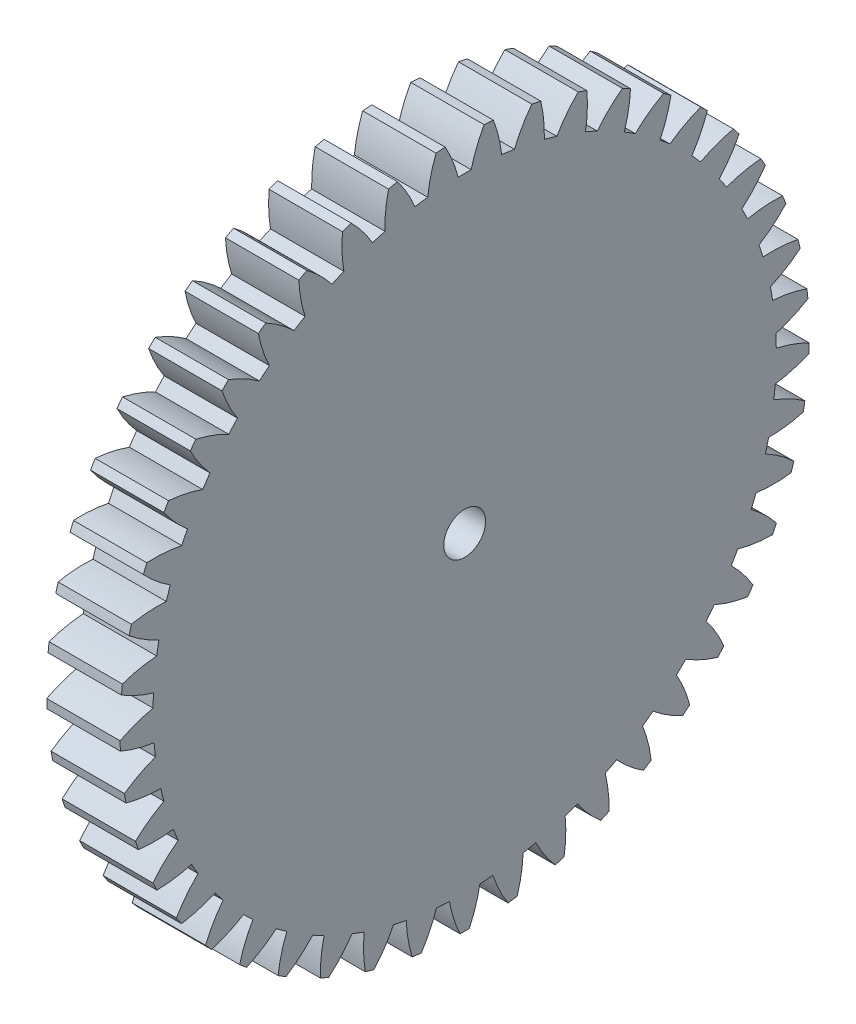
SolidWorks part; units mm, degrees
ref_plane "Plane1" through (0, 0, 0) normal (0, 0, 1) x (1, 0, 0)
ref_plane "Plane2" through (0, 0, 0) normal (0, 1, 0) x (1, 0, 0)
ref_plane "Plane3" through (0, 0, 0) normal (1, 0, 0) x (0, 0, -1)
other "Configuration Table"
sketch "HoldingSke" plane through (0, 0, 0) normal (0, 1, 0) x (1, 0, 0)
  line L0 (0, 0) -> (0.7071, -0.7071)
  line L1 (-15, 0) -> (100, 0) construction
  line L2 (0, 0) -> (-2.1039, 2.3779)
  line L3 (0, 0) -> (-11.863, 4.5341)
  line L4 (0, 0) -> (6.1066, 6.1066)
  line L5 (0, 0) -> (-46.8476, -17.4728)
  line L6 (0, 0) -> (-4.1448, -2.7965)
  line L7 (-2.1039, 2.3779) -> (8.6586, 51.2059)
  line L8 (-76.2, 54.61) -> (-75.9, 54.61)
  line L9 (-71.009, 38.7566) -> (-53.1078, 45.2721)
  line L10 (-76.2, 71.12) -> (104.1128, 71.12)
  line L11 (0, 0) -> (-5, 0)
  line L12 (-76.2, 101.6) -> (-76.162, 101.6)
  line L13 (24.9733, 27.94) -> (52.9518, 28.4284)
  line L14 (24.9733, 27.94) -> (24.9743, 27.94)
  line L15 (24.9733, 27.94) -> (100.4006, 29.5858)
  line L16 (-63.627, -1) -> (-12.827, -1)
  circle A0 centre (0, 0) radius 1
  circle A1 centre (0, 0) radius 21.249
  circle A2 centre (0, 0) radius 37.5
  circle A3 centre (0, 0) radius 1
sketch "BasProSke" plane through (0, 0, 0) normal (0, 1, 0) x (1, 0, 0)
  line L0 (-10, 0) -> (60, 0) construction
  line L1 (0, 0) -> (0, 23.5)
  line L2 (0, 0) -> (5, 0)
  line L3 (5, 0) -> (5, 23.5)
  line L4 (5, 23.5) -> (0, 23.5)
revolve "Base-Revolve" add sketch "BasProSke" angle 360 about L0
sketch "TooCutSke" plane through (0, 0, 0) normal (1, 0, 0) x (0, 0, -1)
  line L1 (0, 0) -> (0, 107) construction
  line L2 (0, 0) -> (-0.8517, 22.4839) construction
  line L3 (0, 0) -> (-3.1374, 44.8675) construction
  line L4 (-0.8517, 22.4839) -> (-1.5687, 22.4337) construction
  arc A0 (0.4426, 21.2444) -> (-0.4426, 21.2444) centre (0, 0) ccw
  arc A1 (1.3407, 23.4872) -> (-1.3407, 23.4872) centre (0, 0) ccw
  circle A2 centre (0, 0) radius 22.5 construction
  circle A3 centre (0, 0) radius 21.1431 construction
  arc A4 (-0.4426, 21.2444) -> (-1.3407, 23.4872) centre (-9.1711, 19.0505) ccw
  arc A5 (1.3407, 23.4872) -> (0.4426, 21.2444) centre (9.1711, 19.0505) ccw
extrude "ToothCut" cut sketch "TooCutSke" along normal through all
fillet "Breaks" [suppressed] radius 0.02
fillet "RootFillets" [suppressed] radius 0.251
pattern_circular "TeethCuts" count 45 every 8 about axis through (-10, 0, 0) along (1, 0, 0) of "ToothCut", "RootFillets", "Breaks"
sketch "HubNeaOneSke" plane through (0, 0, 0) normal (-1, 0, 0) x (0, 0, 1)
  circle A0 centre (0, 0) radius 21.249
extrude "HubNearOne" [suppressed] add sketch "HubNeaOneSke" along normal blind 45.0001
sketch "HubNeaBotSke" plane through (0, 0, 0) normal (-1, 0, 0) x (0, 0, 1)
  circle A0 centre (0, 0) radius 21.249
extrude "HubNearBoth" [suppressed] add sketch "HubNeaBotSke" along normal blind 22.5
ref_plane "FarPln" through (5, 0, 0) normal (1, 0, 0) x (0, 0, -1)
sketch "HubFarSke" plane through (5, 0, 0) normal (1, 0, 0) x (0, 0, -1)
  circle A0 centre (0, 0) radius 21.249
extrude "HubFar" [suppressed] add sketch "HubFarSke" along normal blind 22.5
sketch "BorSke" plane through (0, 0, 0) normal (1, 0, 0) x (0, 0, -1)
  circle A0 centre (0, 0) radius 1
extrude "Bore" cut sketch "BorSke" along normal mid plane 100.0001
sketch "KeySke" plane through (0, 0, 0) normal (1, 0, 0) x (0, 0, -1)
  line L0 (-0.4, 0) -> (-0.4, 1.3)
  line L1 (-0.4, 1.3) -> (0.4, 1.3)
  line L2 (0.4, 1.3) -> (0.4, 0)
  line L3 (0, 0) -> (0, 34) construction
  line L4 (-0.4, 0) -> (0.4, 0)
extrude "Keyway" [suppressed] cut sketch "KeySke" along normal mid plane 100.0001
pattern_circular "Keyway2" [suppressed] count 2 every 90 about axis through (-10, 0, 0) along (1, 0, 0)
sketch "Sketch1" plane through (5, 0, 0) normal (1, 0, 0) x (0, 0, -1)
  circle A0 centre (0, 0) radius 1.425
  dimension "D1" = 2.85
extrude "Cut-Extrude1" cut sketch "Sketch1" against normal blind 10
equation "' \"Module@HoldingSke\" = 6.35"
equation "' \"Num_teeth@HoldingSke\" = 12"
equation "' \"Ap@HoldingSke\" =  20"
equation "' \"Ap@HoldingSke\" = 20"
equation "' \"Width@HoldingSke\" = 0.5 * 25.4"
equation "' \"Hub_dia@HoldingSke\"= 1 * 25.4"
equation "' \"Hub_dia@HoldingSke\" = 1 * 25.4"
equation "' \"Overall_len@HoldingSke\" = 1.0 * 25.4"
equation "' \"Bore@HoldingSke\" = 0.75 * 25.4"
equation "' \"T_dim@HoldingSke\" = 0.1 * 25.4"
equation "' \"Width@KeySke\" = 0.25 * 25.4"
equation "' \"Show_teeth@HoldingSke\" = 13"
equation "' \"Backlash@HoldingSke\" = 0.009 * 25.4"
equation "' \"Addendum_fac@HoldingSke\" = 1.0"
equation "' \"Dedendum_fac@HoldingSke\" = 1.25"
equation "' \"Dedendum_add@HoldingSke\" = 0.00005 * 25.4"
equation "' \"Clearance_fac@HoldingSke\" = 0.25"
equation "\"Pitch@HoldingSke\" = 1 / \"Module@HoldingSke\""
equation "\"Overcut_dia@TooCutSke\" = (\"Num_teeth@HoldingSke\" + 2 * \"Addendum_fac@HoldingSke\") / \"Pitch@HoldingSke\" + 0.002 * 25.4"
equation "\"Pitch_dia@TooCutSke\" = \"Num_teeth@HoldingSke\" / \"Pitch@HoldingSke\""
equation "\"Base_dia@TooCutSke\" = \"Num_teeth@HoldingSke\" / \"Pitch@HoldingSke\" * cos((\"Ap@HoldingSke\"  * 3.14159265 / 180))"
equation "\"Root_dia@TooCutSke\" = (\"Num_teeth@HoldingSke\" + 2) / \"Pitch@HoldingSke\" - 2 * (\"Addendum_fac@HoldingSke\" + \"Dedendum_fac@HoldingSke\") / \"Pitch@HoldingSke\" - \"Dedendum_add@HoldingSke\" * 2"
equation "\"Half_ang@TooCutSke\" = 180 / \"Num_teeth@HoldingSke\""
equation "\"Half_CT@TooCutSke\" = \"Num_teeth@HoldingSke\" / \"Pitch@HoldingSke\" * sin((3.14159265 / 2 / \"Num_teeth@HoldingSke\")) / 2 - 7 * \"Backlash@HoldingSke\" / 4"
equation "\"Flank_rad@TooCutSke\" = \"Num_teeth@HoldingSke\" / \"Pitch@HoldingSke\" / 5"
equation "\"Radius@RootFillets\" = \"Clearance_fac@HoldingSke\" / \"Pitch@HoldingSke\" + \"Dedendum_add@HoldingSke\""
equation "\"Break_rad@Breaks\" = 0.02 / \"Pitch@HoldingSke\""
equation "\"Thickness@HoldingSke\" = \"Width@HoldingSke\""
equation "\"OAL@HoldingSke\" = \"Thickness@HoldingSke\""
equation "\"MHD@HoldingSke\" = (\"Num_teeth@HoldingSke\" + 2) / \"Pitch@HoldingSke\" - 2 * (\"Addendum_fac@HoldingSke\" + \"Dedendum_fac@HoldingSke\")  / \"Pitch@HoldingSke\" - \"Dedendum_add@HoldingSke\" * 2"
equation "\"MBD@HoldingSke\" = (\"Num_teeth@HoldingSke\" + 2) / \"Pitch@HoldingSke\" - 2 * (\"Addendum_fac@HoldingSke\" + \"Dedendum_fac@HoldingSke\")  / \"Pitch@HoldingSke\" - \"Dedendum_add@HoldingSke\" * 2 - 0.002 * 25.4"
equation "\"MHD@HoldingSke\" = ((sgn( \"MHD@HoldingSke\" - \"Hub_dia@HoldingSke\" )-1)*( \"MHD@HoldingSke\" - \"Hub_dia@HoldingSke\" ))/-2+ \"Hub_dia@HoldingSke\""
equation "\"MBD@HoldingSke\" = ((sgn( \"MBD@HoldingSke\" - \"Bore@HoldingSke\" )-1)*( \"MBD@HoldingSke\" - \"Bore@HoldingSke\" ))/-2+ \"Bore@HoldingSke\""
equation "\"OAL@HoldingSke\" = ((sgn( \"OAL@HoldingSke\" - \"Overall_len@HoldingSke\" )+1)*( \"OAL@HoldingSke\" - \"Overall_len@HoldingSke\" ))/2 + \"Overall_len@HoldingSke\" + 0.000002 * 25.4"
equation "\"Num_teeth@TeethCuts\" = int( \"Show_teeth@HoldingSke\" ) + 1"
equation "\"Num_teeth@TeethCuts\" = ((sgn( \"Num_teeth@TeethCuts\" - \"Num_teeth@HoldingSke\" )-1)*( \"Num_teeth@TeethCuts\" - \"Num_teeth@HoldingSke\" ))/-2+ \"Num_teeth@HoldingSke\""
equation "\"Num_teeth@TeethCuts\" = ((sgn( \"Num_teeth@TeethCuts\" - 2.0)+1)*( \"Num_teeth@TeethCuts\" - 2.0))/2 +2.0"
equation "\"Angle@TeethCuts\" = 360.0 / \"Num_teeth@HoldingSke\""
equation "\"Diameter@BasProSke\" = (\"Num_teeth@HoldingSke\" + 2 * \"Addendum_fac@HoldingSke\") / \"Pitch@HoldingSke\""
equation "\"Thickness@BasProSke\"  = \"Thickness@HoldingSke\""
equation "' \"Fillet_rad@BasProSke\" =  \"Thickness@HoldingSke\" * 0.05"
equation "' \"Fillet_rad@BasProSke\" = \"Thickness@HoldingSke\" * 0.05"
equation "\"MHD@HoldingSke\" = ((sgn( \"MHD@HoldingSke\" - \"Root_dia@TooCutSke\" )-1)*( \"MHD@HoldingSke\" - \"Root_dia@TooCutSke\" ))/-2+ \"Root_dia@TooCutSke\""
equation "\"Diameter@HubNeaOneSke\" = \"MHD@HoldingSke\""
equation "\"Length@HubNearOne\" = \"OAL@HoldingSke\" - \"Thickness@BasProSke\""
equation "\"Diameter@HubNeaBotSke\" = \"MHD@HoldingSke\""
equation "\"Length@HubNearBoth\" = ( \"OAL@HoldingSke\" - \"Thickness@BasProSke\" ) / 2.0"
equation "\"Thickness@FarPln\" = \"Thickness@BasProSke\""
equation "\"Diameter@HubFarSke\" = \"MHD@HoldingSke\""
equation "\"Length@HubFar\" = ( \"OAL@HoldingSke\" - \"Thickness@BasProSke\" ) / 2.0"
equation "\"Diameter@BorSke\" = \"MBD@HoldingSke\""
equation "\"D1@Bore\" = \"OAL@HoldingSke\" * 2.0"
equation "\"D1@Keyway\" = \"OAL@HoldingSke\" * 2.0"
equation "\"Offset@KeySke\" = \"T_dim@HoldingSke\" + \"MBD@HoldingSke\" / 2.0"
